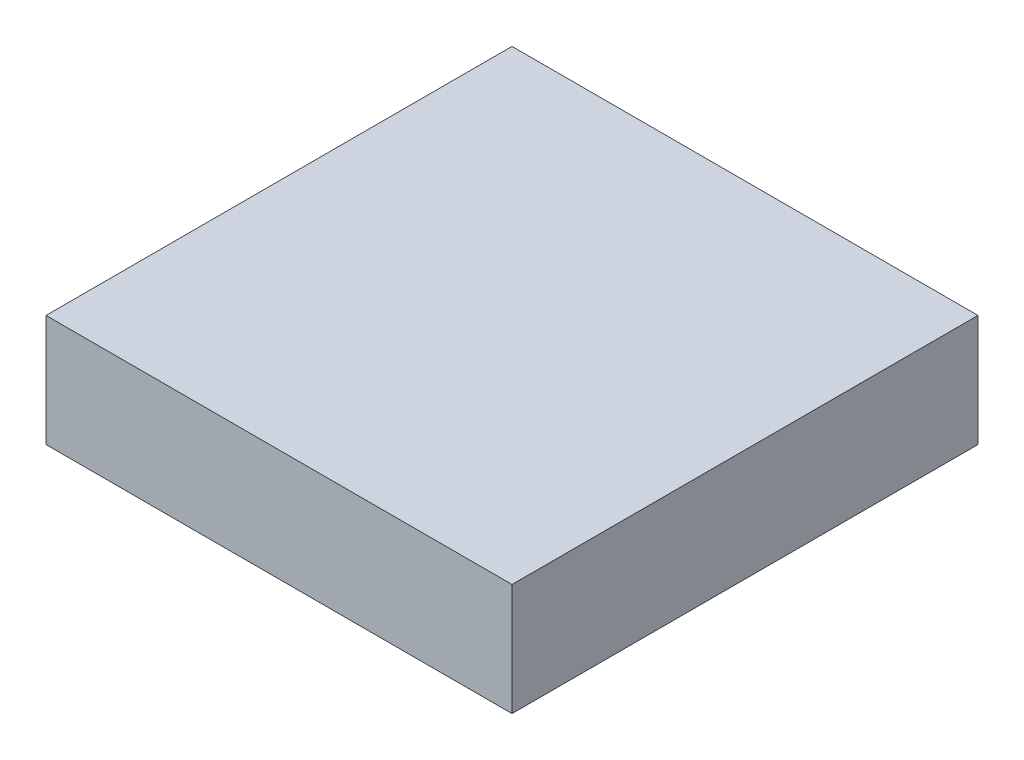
SolidWorks part; units mm, degrees
ref_plane "Front Plane" through (0, 0, 0) normal (0, 0, 1) x (1, 0, 0)
ref_plane "Top Plane" through (0, 0, 0) normal (0, 1, 0) x (1, 0, 0)
ref_plane "Right Plane" through (0, 0, 0) normal (1, 0, 0) x (0, 0, -1)
ref_plane "Plane1" through (0, -100, 0) normal (0, 1, 0) x (1, 0, 0)
sketch "Sketch2" plane through (0, 0, 0) normal (0, 0, 1) x (1, 0, 0)
  line L0 (-91.4776, 0) -> (91.4776, 0) construction
  line L1 (91.4776, 0) -> (211.4776, 0) construction
  line L2 (211.4776, 0) -> (214.9697, -100)
  line L3 (214.9697, -100) -> (0, -100)
  line L4 (0, -100) -> (0, -26.6818)
  arc A0 (-91.4776, 0) -> (91.4776, 0) centre (0, 143.473) ccw construction
  arc A1 (91.4776, 0) -> (211.4776, 0) centre (151.4776, -94.1037) cw
  arc A2 (0, -26.6818) -> (91.4776, 0) centre (0, 143.473) ccw
  dimension "D1" = 182.9552
  dimension "D2" = 170.1548
  dimension "D3" = 120
  dimension "D4" = 100
  dimension "D5" = 88
revolve "Revolve1" add sketch "Sketch2" angle 360 about L4
sketch "Sketch3" plane through (0, -100, 0) normal (0, 1, 0) x (1, 0, 0)
  line L0 (0, 0) -> (0, 239.2054) construction
  line L1 (202.2251, 144.2054) -> (-202.2251, 144.2054) construction
  line L2 (190, 119.2054) -> (190, 239.2054)
  line L3 (190, 239.2054) -> (-187.2101, 239.2054)
  line L4 (-187.2101, 239.2054) -> (-187.2101, 119.2054)
  arc A0 (60, 144.2054) -> (-60, 144.2054) centre (0, 265.1392) cw
  arc A1 (60, 144.2054) -> (190, 119.2054) centre (108.5755, 46.2982) cw
  arc A3 (-60, 144.2054) -> (-187.2101, 119.2054) centre (-107.3184, 48.8321) ccw
  point P5 (0, 130.1392)
  point P6 (0, 144.2054)
  dimension "D1" = 239.2054
  dimension "D3" = 120
  dimension "D4" = 135
  dimension "D5" = 120
  dimension "D2" = 95
  dimension "D6" = 190
extrude "Cut-Extrude1" cut sketch "Sketch3" along normal through all draft 2
sketch "Sketch4" plane through (0, 0, 0) normal (0, 0, 1) x (1, 0, 0)
  line L1 (151.4776, 17.5005) -> (-151.4776, 17.5005)
  arc A0 (-91.4776, 0) -> (-151.4776, 17.5005) centre (-151.4776, -94.1037) ccw construction
  arc A1 (-91.4776, 0) -> (91.4776, 0) centre (0, 143.473) ccw construction
  arc A2 (151.4776, 17.5005) -> (91.4776, 0) centre (151.4776, -94.1037) ccw construction
  arc A3 (-91.4776, 0) -> (-151.4776, 17.5005) centre (-151.4776, -94.1037) ccw
  arc A4 (-91.4776, 0) -> (91.4776, 0) centre (0, 143.473) ccw
  arc A5 (151.4776, 17.5005) -> (91.4776, 0) centre (151.4776, -94.1037) ccw
extrude "Cut-Extrude2" cut sketch "Sketch4" against normal through all
fillet "Fillet1" radius 35 2 edges at (-150.5943, 17.497, -23.1344) (150.5943, 17.497, -23.1344)
fillet "Fillet2" radius 60 2 edges
fillet "Fillet3" radius 5 12 edges at (111.3024, 8.1012, -151.783) (-13.5322, -26.1428, -128.2272) (-116.3146, 8.692, -151.108)
sketch "Sketch5" plane through (0, -100, 0) normal (0, 1, 0) x (1, 0, 0)
  line L0 (91.2072, 0) -> (-91.2072, 0) construction
  circle A0 centre (91.2072, 0) radius 32.5
  circle A1 centre (-91.2072, 0) radius 32.5
  dimension "D1" = 65
extrude "Boss-Extrude1" [suppressed] add sketch "Sketch5" against normal blind 20 draft 10
sketch "Sketch6" plane through (0, -100, 0) normal (0, 1, 0) x (1, 0, 0)
  line L0 (-250, -250) -> (250, 250) construction
  line L1 (-250, -250) -> (250, -250)
  line L2 (-250, -250) -> (-250, 250)
  line L3 (-250, 250) -> (250, 250)
  line L4 (250, -250) -> (250, 250)
  dimension "D1" = 500
extrude "Boss-Extrude2" add sketch "Sketch6" along normal blind 120 separate body
combine bodies "Combine1" operation type subtract main body 106 bodies to subtract 104
